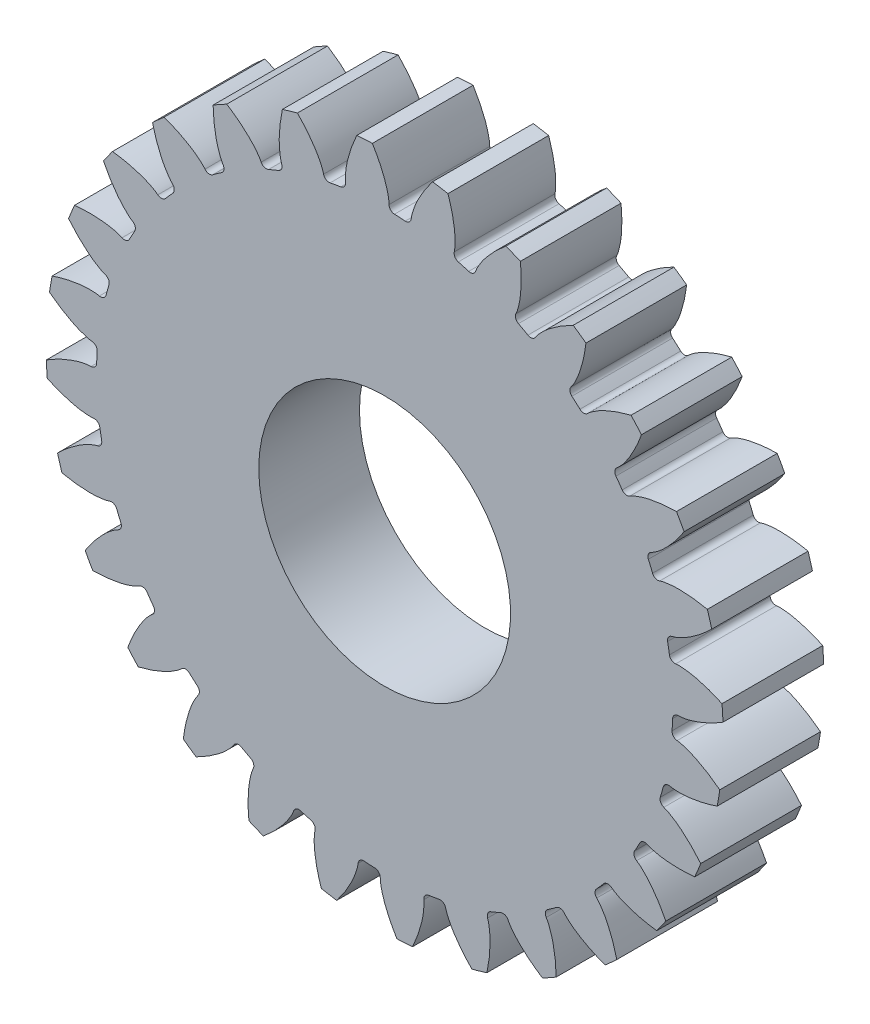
SolidWorks part; units mm, degrees
ref_plane "Face" through (0, 0, 0) normal (0, 0, 1) x (1, 0, 0)
ref_plane "Dessus" through (0, 0, 0) normal (0, 1, 0) x (1, 0, 0)
ref_plane "Droite" through (0, 0, 0) normal (1, 0, 0) x (0, 0, -1)
imported_body "Importée1"
sketch "Esquisse1" plane through (0, 0, 1) normal (0, 0, -1) x (-1, 0, 0)
  circle A0 centre (0, 0) radius 5.699
  dimension "D1" = 11.398
surface "Surface-primitive" sketch "Esquisse1"
